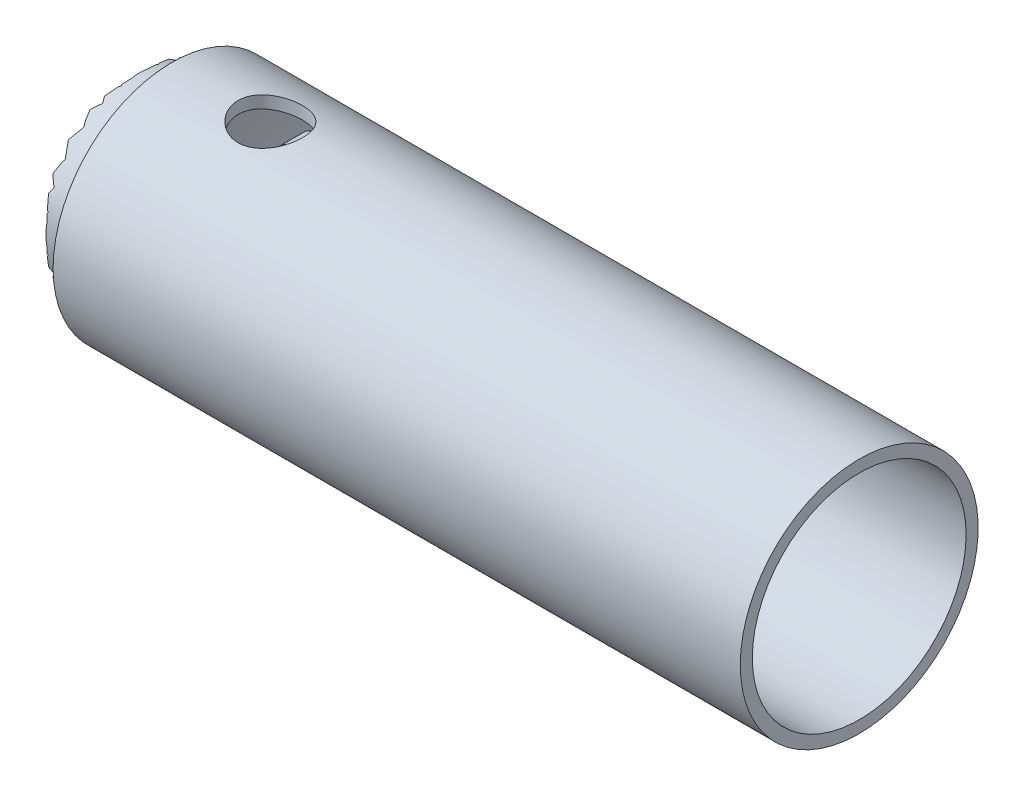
SolidWorks part; units mm, degrees
ref_plane "Front Plane" through (0, 0, 0) normal (0, 0, 1) x (1, 0, 0)
ref_plane "Top Plane" through (0, 0, 0) normal (0, 1, 0) x (1, 0, 0)
ref_plane "Right Plane" through (0, 0, 0) normal (1, 0, 0) x (0, 0, -1)
sketch "Sketch1" plane through (0, 0, 0) normal (0, 0, 1) x (1, 0, 0)
  line L0 (0, 0) -> (50000, 0) construction
  line L1 (0, 0) -> (1.5245, 5.6896)
  line L2 (1.5245, 5.6896) -> (35.5605, 5.6896)
  line L3 (35.5605, 5.6896) -> (35.5605, 6.331)
  line L6 (-1.0155, 6.3309) -> (-1.0155, 4.9784)
  line L7 (-1.0155, 4.9784) -> (-3.0475, 4.9784)
  line L8 (-3.0475, 4.9784) -> (-3.0475, 0)
  line L9 (-3.0475, 0) -> (0, 0)
  line L10 (35.5605, 6.331) -> (-1.0155, 6.3309)
  dimension "D1" = 36.576
  dimension "D2" = 34.036
  dimension "D3" = 75
  dimension "D4" = 38.608
  dimension "D5" = 4.9784
  dimension "D6" = 12.6619
  dimension "D7" = 11.3792
revolve "Revolve2" add sketch "Sketch1" angle 360 about L0
sketch "Sketch2" plane through (0, 0, 0) normal (0, 0, 1) x (1, 0, 0)
  line L0 (1.2705, 12.4737) -> (1.2705, -12.3638) construction
  line L1 (-1.0155, 4.9784) -> (-1.0155, -4.9784) construction
  dimension "D1" = 2.286
ref_plane "Plane1" through (0, 0, 0) normal (0, 0, -1) x (-1, 0, 0)
ref_plane "Plane2" through (0, 6.3309, 0) normal (0, 1, 0) x (-1, 0, 0)
sketch "Sketch4" plane through (0, 6.3309, 0) normal (0, 1, 0) x (-1, 0, 0)
  line L0 (-5.4762, 0) -> (5.4762, 0) construction
  circle A0 centre (-4.217, 0) radius 1.7145
  dimension "D1" = 3.429
extrude "Cut-Extrude1" cut sketch "Sketch4" against normal blind 2.54
ref_plane "Plane5" through (0, -4.9784, 0) normal (0, -1, 0) x (1, 0, 0)
sketch "Sketch11" plane through (-3.0475, 0, 0) normal (-1, 0, 0) x (0, 0, 1)
  line L0 (1.4492, -0.1488) -> (8.72, -0.1488) construction
  line L1 (6.2575, 4.2349) -> (6.2575, -3.1162) construction
sketch "Sketch10" plane through (0, -4.9784, 0) normal (0, -1, 0) x (1, 0, 0)
  line L0 (-3.0475, -0.4953) -> (-2.7315, 0)
  line L1 (-2.7315, 0) -> (-3.0475, 0.4953)
  line L2 (-3.0475, 0.4953) -> (-3.2303, 0)
  line L3 (-3.2303, 0) -> (-3.0475, -0.4953)
  line L4 (-3.0475, 4.9784) -> (-3.0475, -4.9784) construction
  dimension "D1" = 0.9906
extrude "Cut-Extrude2" cut sketch "Sketch10" against normal through all
pattern_linear "LPattern1" count 6 spacing 0.9906 along (0, 0, -1) of "Cut-Extrude2"
ref_plane "Plane6" through (0, 0, -4.9784) normal (0, 0, -1) x (-1, 0, 0)
sketch "Sketch12" plane through (0, 0, -4.9784) normal (0, 0, -1) x (-1, 0, 0)
  line L0 (3.0475, -0.4953) -> (2.7315, 0)
  line L1 (3.0475, -4.9537) -> (3.0475, 4.9537) construction
  line L2 (2.7315, 0) -> (3.0475, 0.4953)
  line L3 (3.0475, 0.4953) -> (3.1952, 0)
  line L4 (3.1952, 0) -> (3.0475, -0.4953)
  dimension "D1" = 0.9906
extrude "Cut-Extrude3" cut sketch "Sketch12" against normal through all
pattern_linear "LPattern2" count 6 spacing 0.9906 along (0, -1, 0) of "Cut-Extrude3"
mirror "Mirror1" about plane through (0, 0, 0) normal (0, 1, 0) of "LPattern2"
pattern_linear "LPattern3" count 6 spacing 0.9906 along (0, 0, 1) of "Cut-Extrude2"
sketch "Sketch6" plane through (0, 0, 0) normal (0, 0, -1) x (-1, 0, 0)
  line L0 (-5.9606, 5.6896) -> (-3.4288, 2.8846)
  line L2 (-3.4288, 2.8846) -> (-3.8105, 2.54)
  line L3 (-3.8105, 2.54) -> (-5.9606, 4.922)
  line L4 (-5.9606, 4.922) -> (-5.9606, 5.6896)
  line L5 (-1.5245, 5.6896) -> (-1.5245, -5.6896) construction
  line L6 (-2.5025, 6.3309) -> (-5.9315, 6.3309) construction
  line L7 (-1.5245, 5.6896) -> (-35.5605, 5.6896) construction
  dimension "D1" = 2.286
  dimension "D2" = 2.54
sketch "Sketch7" plane through (0, 0, 0) normal (0, 0, 1) x (1, 0, 0)
  line L0 (10.0907, 6.3301) -> (6.0637, 6.3301)
  line L1 (5.853, 6.2179) -> (3.5133, 2.74)
  line L2 (3.5133, 2.74) -> (3.8105, 2.54)
  line L3 (3.8105, 2.54) -> (5.9288, 5.6888)
  line L4 (5.9288, 5.6888) -> (10.0907, 5.6888)
  line L5 (10.0907, 5.6888) -> (10.0907, 6.3301)
  line L6 (3.8105, 8.191) -> (3.8105, -2.0813) construction
  line L8 (1.5245, 5.6896) -> (1.5245, -5.6896) construction
  arc A0 (6.0637, 6.3301) -> (5.853, 6.2179) centre (6.0637, 6.0761) ccw
  spline S0 degree 2 poles (5.9315, 6.3309) (4.217, 5.8666) (2.5025, 6.3309) knots 0 0 0 1 1 1 weights 0.004616 0.006331 0.008045 construction
  spline S1 degree 2 poles (5.9315, 5.6896) (4.217, 5.173) (2.5025, 5.6896) knots 0 0 0 1 1 1 weights 0.003975 0.00569 0.007404 construction
  point P18 (5.9285, 6.3301)
  dimension "D4" = 0.254
  dimension "D1" = 2.54
  dimension "D2" = 2.286
  dimension "D3" = 0.6413
ref_plane "Plane3" through (1.447, -0.9734, 0) normal (0.8297, -0.5582, 0) x (0, 0, -1)
sketch "Sketch8" plane through (1.447, -0.9734, 0) normal (0.8297, -0.5582, 0) x (0, 0, -1)
  line L2 (0, 8.9232) -> (0, 0.4) construction
  circle A0 centre (0, 5.9489) radius 1.7145
  dimension "D1" = 3.429
extrude "Boss-Extrude2" add sketch "Sketch8" against normal blind 0.6414
sketch "Sketch9" plane through (0, 0, 0) normal (0, 0, 1) x (1, 0, 0)
  line L0 (10.5834, 5.5958) -> (5.8662, 5.5958)
  line L1 (0.3678, -2.5775) -> (2.5261, 0.6307) construction
  line L2 (10.5834, 5.5958) -> (10.5834, 6.2371)
  line L3 (10.5834, 6.2371) -> (5.9305, 6.2371)
  line L4 (5.2982, 5.9004) -> (3.2784, 2.898)
  line L5 (5.853, 6.2179) -> (3.5133, 2.74) construction
  line L8 (5.8662, 5.5958) -> (5.5194, 5.0802)
  line L9 (5.1924, 5.7431) -> (3.2784, 2.898) construction
  line L10 (3.8105, 2.54) -> (5.7245, 5.3851) construction
  line L11 (5.1086, 5.6185) -> (5.6407, 5.2605)
  arc A0 (5.9305, 6.2371) -> (5.2982, 5.9004) centre (5.9305, 5.4751) ccw
  dimension "D2" = 0.762
  dimension "D1" = 0.6413
extrude "Boss-Extrude3" add sketch "Sketch9" against normal mid plane 1.27
